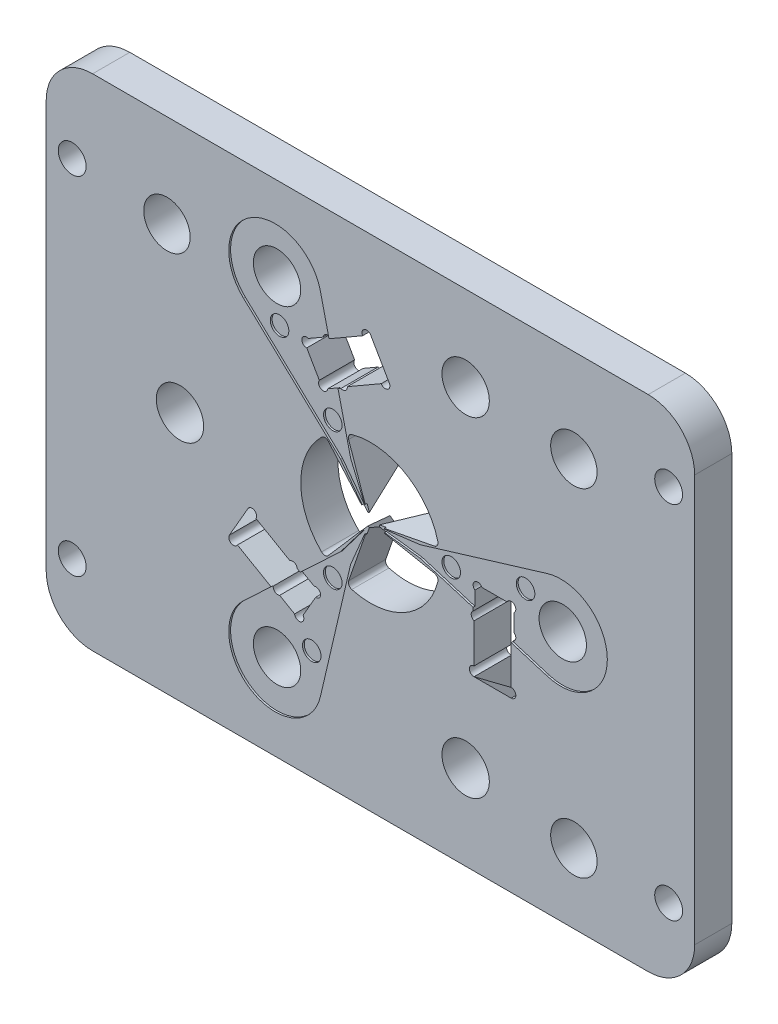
SolidWorks part; units mm, degrees
ref_plane "前基準面" through (0, 0, 0) normal (0, 0, 1) x (1, 0, 0)
ref_plane "上基準面" through (0, 0, 0) normal (0, 1, 0) x (1, 0, 0)
ref_plane "右基準面" through (0, 0, 0) normal (1, 0, 0) x (0, 0, -1)
sketch "草圖1" plane through (0, 0, 0) normal (0, 0, 1) x (1, 0, 0)
  line L1 (-38, 30) -> (38, 30)
  line L2 (-38, 30) -> (-38, -30)
  line L3 (-38, -30) -> (38, -30)
  line L4 (38, 30) -> (38, -30)
  line L5 (-38, 30) -> (38, -30) construction
  line L6 (-38, -30) -> (38, 30) construction
  point P0 (0, 0)
  point P28 (0, 0)
  dimension "D1" = 76
  dimension "D2" = 60
extrude "填料-伸長1" add sketch "草圖1" along normal blind 4
sketch "草圖2" plane through (0, 0, 4) normal (0, 0, 1) x (1, 0, 0)
  line L6 (0.3574, 0.005) -> (20.1903, 2.4807) construction
  line L7 (0.3574, -0.005) -> (20.1903, -2.4807) construction
  line L8 (0.3574, 0.005) -> (4.5094, 0.5233)
  line L9 (0.3574, -0.005) -> (4.5094, -0.5233)
  line L10 (6.1751, 0.8773) -> (19.0478, 4.7845)
  line L11 (6.1751, -0.8773) -> (19.0478, -4.7845)
  line L12 (-2.3278, -5.7864) -> (-5.3804, -18.8881)
  line L13 (-0.1744, -0.312) -> (-1.8015, -4.1669)
  line L14 (-0.183, -0.307) -> (-2.7079, -3.6436)
  line L15 (-3.8473, -4.9091) -> (-13.6674, -14.1037)
  line L16 (-3.8473, 4.9091) -> (-13.6674, 14.1037)
  line L17 (-0.183, 0.307) -> (-2.7079, 3.6436)
  line L18 (-0.1744, 0.312) -> (-1.8015, 4.1669)
  line L19 (-2.3278, 5.7864) -> (-5.3804, 18.8881)
  circle A7 centre (0, 0) radius 0.353 construction
  arc A8 (0.3574, 0.005) -> (0.3574, -0.005) centre (0.358, 0) ccw
  arc A9 (19.0478, -4.7845) -> (19.0478, 4.7845) centre (20.5, 0) ccw
  circle A10 centre (20.5, 0) radius 2.5 construction
  arc A11 (4.5094, -0.5233) -> (6.1751, -0.8773) centre (3.2707, -10.4463) cw
  arc A12 (4.5094, 0.5233) -> (6.1751, 0.8773) centre (3.2707, 10.4463) ccw
  arc A13 (-13.6674, -14.1037) -> (-5.3804, -18.8881) centre (-10.25, -17.7535) ccw
  arc A14 (-1.8015, -4.1669) -> (-2.3278, -5.7864) centre (7.4114, -8.0556) ccw
  arc A15 (-0.1744, -0.312) -> (-0.183, -0.307) centre (-0.179, -0.31) ccw
  arc A16 (-2.7079, -3.6436) -> (-3.8473, -4.9091) centre (-10.6821, 2.3906) cw
  arc A17 (-5.3804, 18.8881) -> (-13.6674, 14.1037) centre (-10.25, 17.7535) ccw
  arc A18 (-2.7079, 3.6436) -> (-3.8473, 4.9091) centre (-10.6821, -2.3906) ccw
  arc A19 (-0.183, 0.307) -> (-0.1744, 0.312) centre (-0.179, 0.31) ccw
  arc A20 (-1.8015, 4.1669) -> (-2.3278, 5.7864) centre (7.4114, 8.0556) cw
  point P17 (5.3574, -0.6291)
  point P20 (5.3574, 0.6291)
  point P46 (0, 0)
  dimension "D1" = 0.706
  dimension "D2" = 0.01
  dimension "D3" = 10
  dimension "D6" = 5
  dimension "D4" = 5
  dimension "D7" = 10
  dimension "D9" = 0.6201
  dimension "D5" = 20.5
  dimension "D8" = 3
extrude "除料-伸長1" cut sketch "草圖2" against normal blind 0.5
sketch "草圖3" plane through (0, 0, 3.5) normal (0, 0, 1) x (1, 0, 0)
  circle A0 centre (20.5, 0) radius 2.55
  circle A3 centre (-10.25, -17.7535) radius 2.55
  circle A4 centre (-10.25, 17.7535) radius 2.55
  point P9 (0, 0)
  dimension "D1" = 5.1
  dimension "D2" = 3
extrude "除料-伸長2" cut sketch "草圖3" against normal through all
sketch "草圖5" plane through (0, 0, 4) normal (0, 0, 1) x (1, 0, 0)
  circle A0 centre (-20.5, 0) radius 2.55
  circle A3 centre (10.25, 17.7535) radius 2.55
  circle A4 centre (10.25, -17.7535) radius 2.55
  point P9 (0, 0)
  dimension "D1" = 5.1
  dimension "D3" = 3
  dimension "D2" = 20.5
extrude "除料-伸長4" cut sketch "草圖5" against normal through all
sketch "草圖6" plane through (0, 0, 4) normal (0, 0, 1) x (1, 0, 0)
  line L0 (-29.9, 26.9) -> (29.9, 26.9)
  line L1 (-38, 30) -> (-38, -30) construction
  line L2 (38, -30) -> (38, 30) construction
  line L3 (-29.9, -26.9) -> (29.9, -26.9)
  line L4 (38, 30) -> (-38, 30) construction
  line L5 (-38, -30) -> (38, -30) construction
  line L6 (-34.9, 21.9) -> (-34.9, -21.9)
  line L7 (34.9, 21.9) -> (34.9, -21.9)
  arc A0 (34.9, 21.9) -> (29.9, 26.9) centre (29.9, 21.9) ccw
  arc A1 (29.9, -26.9) -> (34.9, -21.9) centre (29.9, -21.9) ccw
  arc A2 (-29.9, -26.9) -> (-34.9, -21.9) centre (-29.9, -21.9) cw
  arc A3 (-34.9, 21.9) -> (-29.9, 26.9) centre (-29.9, 21.9) cw
  dimension "D5" = 5
  dimension "D1" = 3.1
  dimension "D2" = 3.1
  dimension "D3" = 3.1
  dimension "D4" = 3.1
extrude "除料-伸長5" cut sketch "草圖6" against normal blind 10 contours L6 A3 L0 A0 L7 A1 L3 A2 M35 M32 M33 M34
ref_plane "平面1" through (0, 0, 4) normal (0, 0, 1) x (1, 0, 0)
sketch "草圖7" plane through (0, 0, 4) normal (0, 0, 1) x (1, 0, 0)
  line L0 (0, 0) -> (34.9, 0) construction
  line L1 (34.9, 21.9) -> (34.9, -21.9) construction
  line L2 (11.05, -0.2286) -> (15.25, -0.2286)
  line L3 (15.25, -0.2286) -> (15.25, -3.3286)
  line L4 (15.25, -3.3286) -> (11.05, -3.3286)
  line L5 (11.05, -3.3286) -> (11.05, -0.2286)
  line L6 (13.15, -0.2286) -> (13.15, -3.3286) construction
  line L7 (11.05, -1.7786) -> (15.25, -1.7786) construction
  line L8 (13.15, -1.7786) -> (11.05, -0.2286) construction
  line L13 (0, 0) -> (-12.75, 22.0836) construction
  line L14 (-6.575, 11.3882) -> (11.1068, 21.5968) construction
  line L15 (-7.4271, 13.3212) -> (-5.3271, 9.6839)
  line L20 (-7.4271, 13.3212) -> (-4.7424, 14.8712)
  line L21 (-4.7424, 14.8712) -> (-2.6424, 11.2339)
  line L22 (-2.6424, 11.2339) -> (-5.3271, 9.6839)
  line L23 (13.15, -1.7786) -> (13.15, -13.7786) construction
  line L24 (11.15, -7.7786) -> (15.15, -7.7786)
  line L25 (15.15, -7.7786) -> (15.15, -8.7786)
  line L26 (15.15, -8.7786) -> (11.15, -8.7786)
  line L27 (11.15, -8.7786) -> (11.15, -7.7786)
  line L28 (11.15, -8.2786) -> (15.15, -8.2786) construction
  line L29 (-6.0847, 14.0962) -> (-3.9847, 10.4589) construction
  line L34 (-7.4271, 13.3212) -> (-2.6424, 11.2339) construction
  line L35 (-4.7424, 14.8712) -> (-5.3271, 9.6839) construction
  line L40 (-0.8386, 17.0096) -> (1.1614, 13.5455)
  line L41 (-0.8386, 17.0096) -> (0.0275, 17.5096)
  line L42 (0.0275, 17.5096) -> (2.0275, 14.0455)
  line L43 (2.0275, 14.0455) -> (1.1614, 13.5455)
  line L44 (-0.4055, 17.2596) -> (1.5945, 13.7955) construction
  line L45 (0, 0) -> (-12.75, -22.0836) construction
  line L46 (-6.575, -11.3882) -> (-21.3666, -2.8483) construction
  line L47 (-5.7229, -9.4553) -> (-7.8229, -13.0926)
  line L48 (-5.7229, -9.4553) -> (-8.4076, -7.9053)
  line L49 (-8.4076, -7.9053) -> (-10.5076, -11.5426)
  line L50 (-10.5076, -11.5426) -> (-7.8229, -13.0926)
  line L51 (-7.0653, -8.6803) -> (-9.1653, -12.3176) construction
  line L52 (-8.4076, -7.9053) -> (-7.8229, -13.0926) construction
  line L53 (-10.5076, -11.5426) -> (-5.7229, -9.4553) construction
  line L54 (-12.3114, -5.7669) -> (-14.3114, -9.231)
  line L55 (-12.3114, -5.7669) -> (-13.1775, -5.2669)
  line L56 (-13.1775, -5.2669) -> (-15.1775, -8.731)
  line L57 (-15.1775, -8.731) -> (-14.3114, -9.231)
  line L58 (-12.7445, -5.5169) -> (-14.7445, -8.981) construction
  line L59 (-4.7841, 14.5007) -> (-3.8841, 12.9418) construction
  line L60 (-10.1659, -11.3935) -> (-9.2659, -9.8347) construction
  circle A0 centre (11.35, -0.45) radius 0.5
  circle A1 centre (14.95, -0.45) radius 0.5
  circle A2 centre (14.95, -3.1071) radius 0.5
  circle A3 centre (11.35, -3.1071) radius 0.5
  circle A4 centre (13.15, -0.9886) radius 0.15 construction
  arc A11 (-5.3804, 18.8881) -> (-13.6674, 14.1037) centre (-10.25, 17.7535) ccw construction
  circle A17 centre (-7.0853, 13.1721) radius 0.5
  circle A18 centre (11.15, -8.2786) radius 0.5
  circle A19 centre (15.15, -8.2786) radius 0.5
  circle A24 centre (-4.7841, 14.5007) radius 0.5
  circle A25 centre (-2.9841, 11.383) radius 0.5
  circle A26 centre (-5.2853, 10.0544) radius 0.5
  circle A27 centre (-0.4055, 17.2596) radius 0.5
  circle A28 centre (1.5945, 13.7955) radius 0.5
  arc A29 (-13.6674, -14.1037) -> (-5.3804, -18.8881) centre (-10.25, -17.7535) ccw construction
  circle A30 centre (-6.0647, -9.6044) radius 0.5
  circle A31 centre (-7.8647, -12.7221) radius 0.5
  circle A32 centre (-10.1659, -11.3935) radius 0.5
  circle A33 centre (-8.3659, -8.2758) radius 0.5
  circle A34 centre (-14.7445, -8.981) radius 0.5
  circle A35 centre (-12.7445, -5.5169) radius 0.5
  point P36 (-6.3771, 11.5025)
  point P43 (0.1614, 15.2775)
  point P66 (-6.7729, -11.2739)
  point P72 (13.15, -7.7786)
  point P81 (-13.3114, -7.4989)
  dimension "D3" = 1
  dimension "D4" = 0.3
  dimension "D10" = 13.15
  dimension "D16" = 1
  dimension "D19" = 4
  dimension "D26" = 1
  dimension "D1" = 4.2
  dimension "D2" = 3.1
  dimension "D5" = 0.79
  dimension "D8" = 0.45
  dimension "D9" = 13.15
  dimension "D11" = 4.2
  dimension "D12" = 3.1
  dimension "D13" = 4
  dimension "D14" = 1
  dimension "D15" = 4.95
  dimension "D17" = 0.3
  dimension "D18" = 0.45
  dimension "D20" = 1
  dimension "D21" = 4.95
  dimension "D22" = 0.3
  dimension "D23" = 13.15
  dimension "D24" = 4.2
  dimension "D25" = 3.1
  dimension "D27" = 0.3
  dimension "D28" = 0.45
  dimension "D29" = 4
  dimension "D30" = 1
  dimension "D31" = 4.95
extrude "除料-伸長6" cut sketch "草圖7" against normal through all
sketch "草圖8" plane through (0, 0, 0) normal (0, 0, 1) x (1, 0, 0)
  line L0 (-34.9, 21.9) -> (-24.9, 21.9) construction
  line L1 (-24.9, 21.9) -> (-24.9, -21.9) construction
  line L2 (-24.9, -21.9) -> (-34.9, -21.9) construction
  line L3 (-34.9, -21.9) -> (-34.9, 21.9) construction
  line L4 (-34.9, 0) -> (34.9, 0) construction
  line L5 (34.9, 21.9) -> (34.9, -21.9) construction
  line L6 (0, 26.9) -> (0, -26.9) construction
  line L7 (-29.9, 26.9) -> (29.9, 26.9) construction
  line L8 (-29.9, -26.9) -> (29.9, -26.9) construction
  circle A0 centre (-32.1, 17.9) radius 1.5
  circle A3 centre (32.1, 19.4) radius 1.5
  circle A4 centre (32.1, -19.4) radius 1.5
  circle A5 centre (-32.1, -19.4) radius 1.5
  dimension "D2" = 3
  dimension "D5" = 3
  dimension "D7" = 2.8
  dimension "D1" = 10
  dimension "D3" = 4
  dimension "D4" = 2.8
  dimension "D6" = 2.5
extrude "除料-伸長7" cut sketch "草圖8" along normal through all contours A3 | A5 | A4 | A0
sketch "草圖10" plane through (0, 0, 3.5) normal (0, 0, 1) x (1, 0, 0)
  line L48 (-3.8473, -4.9091) -> (-7.5662, -8.3911) construction
  line L49 (-7.5662, -8.3911) -> (-6.2611, -9.1446) construction
  line L50 (-6.0971, -10.1033) -> (-7.4488, -12.4446) construction
  line L51 (-8.3611, -12.7819) -> (-9.9695, -11.8533) construction
  line L52 (-10.6531, -11.2814) -> (-13.6674, -14.1037) construction
  line L53 (-5.3804, -18.8881) -> (-2.3278, -5.7864) construction
  line L54 (-1.8015, -4.1669) -> (-0.1744, -0.312) construction
  line L55 (-0.183, -0.307) -> (-2.7079, -3.6436) construction
  line L56 (11.05, -2.357) -> (11.05, -0.85) construction
  line L57 (11.7983, -0.2286) -> (14.5017, -0.2286) construction
  line L58 (15.25, -0.85) -> (15.25, -2.7071) construction
  line L59 (15.0966, -3.5852) -> (19.0478, -4.7845) construction
  line L60 (19.0478, 4.7845) -> (6.1751, 0.8773) construction
  line L61 (4.5094, 0.5233) -> (0.3574, 0.005) construction
  line L62 (0.3574, -0.005) -> (4.5094, -0.5233) construction
  line L63 (6.1751, -0.8773) -> (11.05, -2.357) construction
  line L64 (-3.4838, 10.7481) -> (-4.7889, 9.9946) construction
  line L65 (-5.7012, 10.3319) -> (-7.0529, 12.6731) construction
  line L66 (-6.8889, 13.6319) -> (-5.2805, 14.5605) construction
  line L67 (-4.4434, 14.8666) -> (-5.3804, 18.8881) construction
  line L68 (-13.6674, 14.1037) -> (-3.8473, 4.9091) construction
  line L69 (-2.7079, 3.6436) -> (-0.183, 0.307) construction
  line L70 (-0.1744, 0.312) -> (-1.8015, 4.1669) construction
  line L71 (-2.3278, 5.7864) -> (-3.4838, 10.7481) construction
  line L72 (-3.8473, -4.9091) -> (-7.5662, -8.3911)
  line L73 (-7.5662, -8.3911) -> (-6.2611, -9.1446)
  line L74 (-6.0971, -10.1033) -> (-7.4488, -12.4446)
  line L75 (-8.3611, -12.7819) -> (-9.9695, -11.8533)
  line L76 (-10.6531, -11.2814) -> (-13.6674, -14.1037)
  line L77 (-5.3804, -18.8881) -> (-2.3278, -5.7864)
  line L78 (-1.8015, -4.1669) -> (-0.1744, -0.312)
  line L79 (-0.183, -0.307) -> (-2.7079, -3.6436)
  line L80 (11.05, -2.357) -> (11.05, -0.85)
  line L81 (11.7983, -0.2286) -> (14.5017, -0.2286)
  line L82 (15.25, -0.85) -> (15.25, -2.7071)
  line L83 (15.0966, -3.5852) -> (19.0478, -4.7845)
  line L84 (19.0478, 4.7845) -> (6.1751, 0.8773)
  line L85 (4.5094, 0.5233) -> (0.3574, 0.005)
  line L86 (0.3574, -0.005) -> (4.5094, -0.5233)
  line L87 (6.1751, -0.8773) -> (11.05, -2.357)
  line L88 (-3.4838, 10.7481) -> (-4.7889, 9.9946)
  line L89 (-5.7012, 10.3319) -> (-7.0529, 12.6731)
  line L90 (-6.8889, 13.6319) -> (-5.2805, 14.5605)
  line L91 (-4.4434, 14.8666) -> (-5.3804, 18.8881)
  line L92 (-13.6674, 14.1037) -> (-3.8473, 4.9091)
  line L93 (-2.7079, 3.6436) -> (-0.183, 0.307)
  line L94 (-0.1744, 0.312) -> (-1.8015, 4.1669)
  line L95 (-2.3278, 5.7864) -> (-3.4838, 10.7481)
  circle A42 centre (-10.25, 17.7535) radius 2.55
  circle A43 centre (-10.25, -17.7535) radius 2.55
  circle A44 centre (20.5, 0) radius 2.55
  arc A45 (-6.0971, -10.1033) -> (-6.2611, -9.1446) centre (-6.0647, -9.6044) ccw construction
  arc A46 (-8.3611, -12.7819) -> (-7.4488, -12.4446) centre (-7.8647, -12.7221) ccw construction
  arc A47 (-10.6531, -11.2814) -> (-9.9695, -11.8533) centre (-10.1659, -11.3935) ccw construction
  arc A48 (-13.6674, -14.1037) -> (-5.3804, -18.8881) centre (-10.25, -17.7535) ccw construction
  arc A49 (-1.8015, -4.1669) -> (-2.3278, -5.7864) centre (7.4114, -8.0556) ccw construction
  arc A50 (-0.1744, -0.312) -> (-0.183, -0.307) centre (-0.179, -0.31) ccw construction
  arc A51 (-3.8473, -4.9091) -> (-2.7079, -3.6436) centre (-10.6821, 2.3906) ccw construction
  arc A52 (11.7983, -0.2286) -> (11.05, -0.85) centre (11.35, -0.45) ccw construction
  arc A53 (15.25, -0.85) -> (14.5017, -0.2286) centre (14.95, -0.45) ccw construction
  arc A54 (15.0966, -3.5852) -> (15.25, -2.7071) centre (14.95, -3.1071) ccw construction
  arc A55 (19.0478, -4.7845) -> (19.0478, 4.7845) centre (20.5, 0) ccw construction
  arc A56 (4.5094, 0.5233) -> (6.1751, 0.8773) centre (3.2707, 10.4463) ccw construction
  arc A57 (0.3574, 0.005) -> (0.3574, -0.005) centre (0.358, 0) ccw construction
  arc A58 (6.1751, -0.8773) -> (4.5094, -0.5233) centre (3.2707, -10.4463) ccw construction
  arc A59 (-5.7012, 10.3319) -> (-4.7889, 9.9946) centre (-5.2853, 10.0544) ccw construction
  arc A60 (-6.8889, 13.6319) -> (-7.0529, 12.6731) centre (-7.0853, 13.1721) ccw construction
  arc A61 (-4.4434, 14.8666) -> (-5.2805, 14.5605) centre (-4.7841, 14.5007) ccw construction
  arc A62 (-5.3804, 18.8881) -> (-13.6674, 14.1037) centre (-10.25, 17.7535) ccw construction
  arc A63 (-2.7079, 3.6436) -> (-3.8473, 4.9091) centre (-10.6821, -2.3906) ccw construction
  arc A64 (-0.183, 0.307) -> (-0.1744, 0.312) centre (-0.179, 0.31) ccw construction
  arc A65 (-2.3278, 5.7864) -> (-1.8015, 4.1669) centre (7.4114, 8.0556) ccw construction
  arc A66 (-6.0971, -10.1033) -> (-6.2611, -9.1446) centre (-6.0647, -9.6044) ccw
  arc A67 (-8.3611, -12.7819) -> (-7.4488, -12.4446) centre (-7.8647, -12.7221) ccw
  arc A68 (-10.6531, -11.2814) -> (-9.9695, -11.8533) centre (-10.1659, -11.3935) ccw
  arc A69 (-13.6674, -14.1037) -> (-5.3804, -18.8881) centre (-10.25, -17.7535) ccw
  arc A70 (-1.8015, -4.1669) -> (-2.3278, -5.7864) centre (7.4114, -8.0556) ccw
  arc A71 (-0.1744, -0.312) -> (-0.183, -0.307) centre (-0.179, -0.31) ccw
  arc A72 (-3.8473, -4.9091) -> (-2.7079, -3.6436) centre (-10.6821, 2.3906) ccw
  arc A73 (11.7983, -0.2286) -> (11.05, -0.85) centre (11.35, -0.45) ccw
  arc A74 (15.25, -0.85) -> (14.5017, -0.2286) centre (14.95, -0.45) ccw
  arc A75 (15.0966, -3.5852) -> (15.25, -2.7071) centre (14.95, -3.1071) ccw
  arc A76 (19.0478, -4.7845) -> (19.0478, 4.7845) centre (20.5, 0) ccw
  arc A77 (4.5094, 0.5233) -> (6.1751, 0.8773) centre (3.2707, 10.4463) ccw
  arc A78 (0.3574, 0.005) -> (0.3574, -0.005) centre (0.358, 0) ccw
  arc A79 (6.1751, -0.8773) -> (4.5094, -0.5233) centre (3.2707, -10.4463) ccw
  arc A80 (-5.7012, 10.3319) -> (-4.7889, 9.9946) centre (-5.2853, 10.0544) ccw
  arc A81 (-6.8889, 13.6319) -> (-7.0529, 12.6731) centre (-7.0853, 13.1721) ccw
  arc A82 (-4.4434, 14.8666) -> (-5.2805, 14.5605) centre (-4.7841, 14.5007) ccw
  arc A83 (-5.3804, 18.8881) -> (-13.6674, 14.1037) centre (-10.25, 17.7535) ccw
  arc A84 (-2.7079, 3.6436) -> (-3.8473, 4.9091) centre (-10.6821, -2.3906) ccw
  arc A85 (-0.183, 0.307) -> (-0.1744, 0.312) centre (-0.179, 0.31) ccw
  arc A86 (-2.3278, 5.7864) -> (-1.8015, 4.1669) centre (7.4114, 8.0556) ccw
  dimension "D1" = 5.1
  dimension "D2" = 5.1
  dimension "D3" = 5.1
extrude "填料-伸長2" add sketch "草圖10" along normal blind 0.5
sketch "草圖11" plane through (0, 0, 4) normal (0, 0, 1) x (1, 0, 0)
  line L0 (20.1778, 2.5296) -> (0.3574, 0.005) construction
  line L1 (0.3574, -0.005) -> (20.1778, -2.5296) construction
  line L2 (0.3574, 0.005) -> (5.3574, 0.6418) construction
  line L3 (0.3574, -0.005) -> (5.3574, -0.6418) construction
  line L4 (5.3574, 0.6418) -> (19.0519, 4.7857) construction
  line L5 (5.3574, -0.6418) -> (19.0519, -4.7857) construction
  line L6 (-0.183, -0.307) -> (-3.2345, -4.3187) construction
  line L7 (-3.2345, -4.3187) -> (-13.6705, -14.1066) construction
  line L8 (-2.1228, -4.9605) -> (-5.3814, -18.8923) construction
  line L9 (-0.1744, -0.312) -> (-2.1228, -4.9605) construction
  line L10 (-0.1744, 0.312) -> (-2.1228, 4.9605) construction
  line L11 (-2.1228, 4.9605) -> (-5.3814, 18.8923) construction
  line L12 (-3.2345, 4.3187) -> (-13.6705, 14.1066) construction
  line L13 (-0.183, 0.307) -> (-3.2345, 4.3187) construction
  line L14 (-0.1744, 0.312) -> (-2.1228, 4.9605) construction
  line L16 (-0.183, 0.307) -> (-3.2345, 4.3187) construction
  line L18 (-0.1744, -0.312) -> (-2.1228, -4.9605) construction
  line L20 (-0.183, -0.307) -> (-3.2345, -4.3187) construction
  line L22 (0.3574, -0.005) -> (5.3574, -0.6418) construction
  line L24 (0.3574, 0.005) -> (5.3574, 0.6418) construction
  line L26 (6.872, 1.2601) -> (0.3574, 0.005)
  line L27 (6.872, -1.2601) -> (0.3574, -0.005)
  line L32 (-2.3448, -6.5814) -> (-0.1744, -0.312)
  line L33 (-4.5273, -5.3213) -> (-0.183, -0.307)
  line L34 (-4.5273, 5.3213) -> (-0.183, 0.307)
  line L35 (-2.3448, 6.5814) -> (-0.1744, 0.312)
  circle A0 centre (0, 0) radius 0.353 construction
  arc A1 (0.3574, 0.005) -> (0.3574, -0.005) centre (0.358, 0) ccw construction
  circle A4 centre (20.5, 0) radius 2.55 construction
  circle A5 centre (20.5, 0) radius 2.55 construction
  arc A6 (19.0519, -4.7857) -> (19.0519, 4.7857) centre (20.5, 0) ccw construction
  arc A7 (-0.1744, -0.312) -> (-0.183, -0.307) centre (-0.179, -0.31) ccw construction
  arc A8 (-13.6705, -14.1066) -> (-5.3814, -18.8923) centre (-10.25, -17.7535) ccw construction
  arc A9 (-0.183, 0.307) -> (-0.1744, 0.312) centre (-0.179, 0.31) ccw construction
  arc A10 (-5.3814, 18.8923) -> (-13.6705, 14.1066) centre (-10.25, 17.7535) ccw construction
  arc A12 (-0.183, 0.307) -> (-0.1744, 0.312) centre (-0.179, 0.31) ccw
  arc A13 (-0.1744, -0.312) -> (-0.183, -0.307) centre (-0.179, -0.31) ccw
  arc A15 (0.3574, 0.005) -> (0.3574, -0.005) centre (0.358, 0) ccw
  arc A22 (-5.2555, 5.3506) -> (-5.2555, -5.3506) centre (0, 0) ccw
  arc A23 (-2.006, -7.2267) -> (7.2616, -1.8761) centre (0, 0) ccw
  arc A24 (7.2616, 1.8761) -> (-2.006, 7.2267) centre (0, 0) ccw
  arc A25 (6.872, 1.2601) -> (7.2616, 1.8761) centre (6.7775, 1.751) ccw
  arc A26 (6.872, -1.2601) -> (7.2616, -1.8761) centre (6.7775, -1.751) cw
  arc A27 (-2.3448, -6.5814) -> (-2.006, -7.2267) centre (-1.8723, -6.745) ccw
  arc A28 (-4.5273, -5.3213) -> (-5.2555, -5.3506) centre (-4.9052, -4.9939) cw
  arc A29 (-4.5273, 5.3213) -> (-5.2555, 5.3506) centre (-4.9052, 4.9939) ccw
  arc A30 (-2.3448, 6.5814) -> (-2.006, 7.2267) centre (-1.8723, 6.745) cw
  point P35 (0, 0)
  point P45 (7.3762, 1.3572)
  point P48 (0, 0)
  point P52 (7.3762, -1.3572)
  dimension "D1" = 0.706
  dimension "D2" = 0.01
  dimension "D3" = 5
  dimension "D4" = 10
  dimension "D6" = 15
  dimension "D7" = 0.1
  dimension "D10" = 0.5
  dimension "D11" = 0.5
  dimension "D12" = 0.5
  dimension "D13" = 0.5
  dimension "D14" = 0.5
  dimension "D15" = 0.5
  dimension "D8" = 0.1
  dimension "D9" = 3
  dimension "D5" = 3
extrude "除料-伸長9" cut sketch "草圖11" against normal through all
sketch "草圖12" plane through (0, 0, 0) normal (0, 1, 0) x (1, 0, 0)
  line L0 (0, 0) -> (0, -5.1664) construction
  line L2 (-29.9, 0) -> (29.9, 0) construction
  line L6 (0.353, -4.18) -> (0.353, 0)
  line L7 (0.353, 0) -> (2.7663, 0)
  line L8 (2.7663, 0) -> (0.353, -4.18)
  line L9 (-29.59, -4) -> (29.59, -4) construction
  dimension "D1" = 0.353
  dimension "D2" = 0.18
  dimension "D3" = 30
revolve "除料-旋轉1" cut sketch "草圖12" angle 360 about L0
sketch "草圖13" plane through (0, 0, 0) normal (0, 0, -1) x (-1, 0, 0)
  line L0 (29.9, 26.9) -> (-29.9, 26.9) construction
  line L1 (-34.9, 21.9) -> (-34.9, -21.9) construction
  line L2 (0, 26.9) -> (0, -26.9) construction
  line L3 (29.9, -26.9) -> (-29.9, -26.9) construction
  circle A0 centre (-21.9, 16.9) radius 2.5
  circle A1 centre (21.9, 16.9) radius 2.5
  circle A2 centre (-21.9, -19.4) radius 2.5
  dimension "D1" = 5
  dimension "D4" = 5
  dimension "D2" = 10
  dimension "D3" = 13
  dimension "D5" = 7.5
extrude "除料-伸長10" cut sketch "草圖13" against normal through all
sketch "草圖14" plane through (0, 0, 4) normal (0, 0, 1) x (1, 0, 0)
  line L0 (13.15, -0.2286) -> (13.15, -8.7786) construction
  line L1 (11.7983, -0.2286) -> (14.5017, -0.2286) construction
  line L2 (15.15, -8.7786) -> (11.15, -8.7786) construction
  line L3 (14.2511, -3.3286) -> (11.7983, -3.3286) construction
  line L4 (11.15, -3.3286) -> (15.15, -3.3286)
  line L5 (11.15, -3.3286) -> (11.15, -7.7786)
  line L6 (11.15, -7.7786) -> (15.15, -7.7786)
  line L7 (15.15, -3.3286) -> (15.15, -7.7786)
  line L8 (11.15, -3.3286) -> (15.15, -7.7786) construction
  line L9 (11.15, -7.7786) -> (15.15, -3.3286) construction
  line L10 (-6.3771, 11.5025) -> (1.0275, 15.7775) construction
  line L11 (-5.7012, 10.3319) -> (-7.0529, 12.6731) construction
  line L12 (0.0275, 17.5096) -> (2.0275, 14.0455) construction
  line L14 (-4.6924, 14.7846) -> (-2.6924, 11.3205)
  line L15 (-4.6924, 14.7846) -> (-0.8386, 17.0096)
  line L16 (-0.8386, 17.0096) -> (1.1614, 13.5455)
  line L17 (-2.6924, 11.3205) -> (1.1614, 13.5455)
  line L18 (-4.6924, 14.7846) -> (1.1614, 13.5455) construction
  line L19 (-0.8386, 17.0096) -> (-2.6924, 11.3205) construction
  line L21 (-0.8386, 17.0096) -> (1.1614, 13.5455) construction
  line L22 (-4.2429, 14.0061) -> (-3.0165, 11.8819) construction
  line L23 (-6.7729, -11.2739) -> (-13.3114, -7.4989) construction
  line L24 (-6.0971, -10.1033) -> (-7.4488, -12.4446) construction
  line L25 (-12.3114, -5.7669) -> (-14.3114, -9.231) construction
  line L26 (-8.7818, -8.5533) -> (-10.0082, -10.6776) construction
  line L27 (-14.3114, -9.231) -> (-12.3114, -5.7669)
  line L28 (-14.3114, -9.231) -> (-10.4576, -11.456)
  line L29 (-10.4576, -11.456) -> (-8.4576, -7.9919)
  line L30 (-12.3114, -5.7669) -> (-8.4576, -7.9919)
  line L31 (-14.3114, -9.231) -> (-8.4576, -7.9919) construction
  line L32 (-10.4576, -11.456) -> (-12.3114, -5.7669) construction
  point P6 (13.15, -5.5536)
  point P20 (-1.7655, 14.165)
  point P29 (-11.3845, -8.6114)
extrude "除料-伸長11" cut sketch "草圖14" against normal blind 0.9
sketch "草圖15" plane through (0, 0, 0) normal (0, 1, 0) x (1, 0, 0)
  line L0 (0, 0) -> (0, -4.2669) construction
  line L1 (0.353, 0) -> (0.353, -4.18)
  line L6 (-29.59, -4) -> (29.59, -4) construction
  line L7 (0.353, -4.18) -> (0.553, -4.18)
  line L8 (0.553, -4.18) -> (2.9663, 0)
  line L9 (0.353, 0) -> (2.9663, 0)
  line L10 (-29.9, 0) -> (29.9, 0) construction
  dimension "D1" = 0.353
  dimension "D2" = 0.18
  dimension "D3" = 30
  dimension "D4" = 0.2
revolve "除料-旋轉2" cut sketch "草圖15" angle 360 about L0
sketch "草圖16" plane through (0, 0, 4) normal (0, 0, 1) x (1, 0, 0)
  line L0 (0.3574, 0.005) -> (20.1903, 2.4807) construction
  line L1 (20.1903, -2.4807) -> (0.3574, -0.005) construction
  line L2 (0.3574, 0.005) -> (5.358, 0.6292)
  line L3 (0.3574, -0.005) -> (5.358, -0.6292)
  line L4 (5.358, 0.6292) -> (19.0478, 4.7845)
  line L5 (5.358, -0.6292) -> (19.0478, -4.7845)
  line L6 (-0.183, -0.307) -> (-3.2239, -4.3256)
  line L7 (-3.2239, -4.3256) -> (-13.6673, -14.1036)
  line L8 (-2.1341, -4.9548) -> (-5.3804, -18.8881)
  line L9 (-0.1744, -0.312) -> (-2.1341, -4.9548)
  line L10 (-0.1744, -0.312) -> (-7.9468, -18.7257) construction
  line L11 (-12.2436, -16.245) -> (-0.183, -0.307) construction
  line L12 (-0.1744, 0.312) -> (-2.1341, 4.9548)
  line L13 (-2.1341, 4.9548) -> (-5.3804, 18.8881)
  line L14 (-3.2239, 4.3256) -> (-13.6673, 14.1036)
  line L15 (-0.183, 0.307) -> (-3.2239, 4.3256)
  line L16 (-0.183, 0.307) -> (-12.2436, 16.245) construction
  line L17 (-7.9468, 18.7257) -> (-0.1744, 0.312) construction
  circle A0 centre (0, 0) radius 0.353 construction
  arc A1 (0.3574, 0.005) -> (0.3574, -0.005) centre (0.358, 0) ccw
  circle A2 centre (20.5, 0) radius 2.5 construction
  arc A4 (19.0478, -4.7845) -> (19.0478, 4.7845) centre (20.5, 0) ccw
  arc A5 (-0.1744, -0.312) -> (-0.183, -0.307) centre (-0.179, -0.31) ccw
  arc A6 (-13.6673, -14.1036) -> (-5.3804, -18.8881) centre (-10.25, -17.7535) ccw
  circle A7 centre (-10.25, -17.7535) radius 2.5 construction
  arc A8 (-0.183, 0.307) -> (-0.1744, 0.312) centre (-0.179, 0.31) ccw
  arc A9 (-5.3804, 18.8881) -> (-13.6673, 14.1036) centre (-10.25, 17.7535) ccw
  circle A10 centre (-10.25, 17.7535) radius 2.5 construction
  point P39 (0, 0)
  dimension "D1" = 0.706
  dimension "D2" = 0.01
  dimension "D3" = 5
  dimension "D4" = 10
  dimension "D5" = 5
  dimension "D6" = 3
extrude "除料-伸長12" cut sketch "草圖16" against normal blind 0.2
ref_plane "平面2" through (11.15, 0, 0) normal (1, 0, 0) x (0, 0, -1)
sketch "草圖17" plane through (11.15, 0, 0) normal (1, 0, 0) x (0, 0, -1)
  line L7 (0, -11.7786) -> (0, -8.7786)
  line L8 (0, -10.1033) -> (0, -12.4446) construction
  line L9 (0, -8.7786) -> (0, -7.7786) construction
  line L10 (0, -5.7669) -> (0, -9.231) construction
  line L11 (0, -8.7786) -> (-4, -8.7786)
  line L12 (-4, 29.59) -> (-4, -29.59) construction
  line L14 (-4, -8.7786) -> (0, -11.7786)
  line L22 (-4, -8.7786) -> (0, -8.7786)
  line L23 (0, -8.7786) -> (0, -7.7786)
  line L24 (0, -7.7786) -> (-3.1, -7.7786)
  line L25 (-3.1, -7.7786) -> (-4, -7.7786)
  line L26 (-4, -7.7786) -> (-4, -8.7786)
  line L27 (-4, -8.7786) -> (0, -8.7786) construction
  line L28 (0, -8.7786) -> (0, -7.7786) construction
  line L29 (0, -7.7786) -> (-3.1, -7.7786) construction
  line L30 (-3.1, -7.7786) -> (-4, -7.7786) construction
  line L31 (-4, -7.7786) -> (-4, -8.7786) construction
  dimension "D1" = 3
  dimension "D2" = 0
extrude "除料-伸長15" cut sketch "草圖17" along normal blind 4
ref_plane "平面3" through (-5.575, 9.6562, 0) normal (-0.5, 0.866, 0) x (0.866, 0.5, 0)
sketch "草圖18" plane through (-5.575, 9.6562, 0) normal (-0.5, 0.866, 0) x (0.866, 0.5, 0)
  line L7 (8.7786, -4) -> (8.7786, 0)
  line L8 (8.7786, 0) -> (11.7786, 0)
  line L9 (10.1033, 0) -> (12.4446, 0) construction
  line L10 (11.7786, 0) -> (8.7786, -4)
  line L12 (7.7786, 0) -> (7.7786, -3.1)
  line L13 (7.7786, -3.1) -> (7.7786, -4)
  line L14 (7.7786, -4) -> (8.7786, -4)
  line L15 (8.7786, -4) -> (8.7786, 0)
  line L16 (8.7786, 0) -> (7.7786, 0)
  line L17 (7.7786, 0) -> (7.7786, -3.1) construction
  line L18 (7.7786, -3.1) -> (7.7786, -4) construction
  line L19 (7.7786, -4) -> (8.7786, -4) construction
  line L20 (8.7786, -4) -> (8.7786, 0) construction
  line L21 (8.7786, 0) -> (7.7786, 0) construction
  dimension "D1" = 3
  dimension "D2" = 0
extrude "除料-伸長16" cut sketch "草圖18" along normal blind 4
ref_plane "平面4" through (-5.575, -9.6562, 0) normal (-0.5, -0.866, 0) x (-0.866, 0.5, 0)
sketch "草圖19" plane through (-5.575, -9.6562, 0) normal (-0.5, -0.866, 0) x (-0.866, 0.5, 0)
  line L4 (8.7786, -4) -> (8.7786, 0)
  line L5 (7.7786, 0) -> (7.7786, -3.1)
  line L6 (7.7786, -3.1) -> (7.7786, -4)
  line L7 (7.7786, -4) -> (8.7786, -4)
  line L8 (8.7786, -4) -> (8.7786, 0)
  line L9 (8.7786, 0) -> (7.7786, 0)
  line L10 (7.7786, 0) -> (7.7786, -3.1) construction
  line L11 (7.7786, -3.1) -> (7.7786, -4) construction
  line L12 (7.7786, -4) -> (8.7786, -4) construction
  line L13 (8.7786, -4) -> (8.7786, 0) construction
  line L14 (8.7786, 0) -> (7.7786, 0) construction
  line L15 (8.7786, 0) -> (11.7786, 0)
  line L16 (12.4446, 0) -> (10.1033, 0) construction
  line L17 (11.7786, 0) -> (8.7786, -4)
  dimension "D2" = 3
  dimension "D1" = 0
extrude "除料-伸長17" cut sketch "草圖19" along normal blind 4
ref_plane "平面5" through (0, 0, 4) normal (0, 0, 1) x (1, 0, 0)
sketch "草圖20" plane through (0, 0, 4) normal (0, 0, 1) x (1, 0, 0)
  line L0 (0, 0) -> (34.9, 0) construction
  line L1 (34.9, 21.9) -> (34.9, -21.9) construction
  line L2 (1.5193, 0) -> (1.5193, 0.15) construction
  line L3 (5.358, 0.6292) -> (0.6556, 0.0422) construction
  circle A0 centre (0, 0) radius 1.5266
  dimension "D1" = 0.15
extrude "除料-伸長18" cut sketch "草圖20" against normal blind 0.2
ref_plane "平面6" through (0, 0, 3.8) normal (0, 0, 1) x (1, 0, 0)
sketch "草圖21" plane through (0, 0, 3.8) normal (0, 0, 1) x (1, 0, 0)
  line L0 (0, 0) -> (34.9, 0) construction
  line L1 (34.9, 21.9) -> (34.9, -21.9) construction
  line L2 (16.5, 0) -> (16.5, 2) construction
  circle A0 centre (8.5, 0) radius 1
  circle A1 centre (16.5, 2) radius 1
  circle A2 centre (-6.5179, -15.2894) radius 1
  circle A3 centre (-4.25, -7.3612) radius 1
  circle A4 centre (-9.9821, 13.2894) radius 1
  circle A5 centre (-4.25, 7.3612) radius 1
  point P20 (0, 0)
  dimension "D1" = 2
  dimension "D5" = 2
  dimension "D2" = 8.5
  dimension "D3" = 8
  dimension "D4" = 2
  dimension "D6" = 3
extrude "除料-伸長19" cut sketch "草圖21" against normal blind 0.2
sketch "草圖22" plane through (0, 0, 3.1) normal (0, 0, 1) x (1, 0, 0)
  line L4 (-4.3682, 14.2231) -> (-3.0165, 11.8819)
  line L5 (-2.4873, 11.4389) -> (1.1614, 13.5455)
  line L6 (1.1614, 13.5455) -> (-0.8386, 17.0096)
  line L7 (-0.8386, 17.0096) -> (-4.4873, 14.903)
  line L8 (-4.3682, 14.2231) -> (-3.0165, 11.8819)
  line L9 (-2.4873, 11.4389) -> (1.1614, 13.5455)
  line L10 (1.1614, 13.5455) -> (-0.8386, 17.0096)
  line L11 (-0.8386, 17.0096) -> (-4.4873, 14.903)
  line L12 (-10.1335, -10.8946) -> (-8.7818, -8.5533)
  line L13 (-8.6627, -7.8735) -> (-12.3114, -5.7669)
  line L14 (-12.3114, -5.7669) -> (-14.3114, -9.231)
  line L15 (-14.3114, -9.231) -> (-10.6627, -11.3376)
  line L16 (-10.1335, -10.8946) -> (-8.7818, -8.5533)
  line L17 (-8.6627, -7.8735) -> (-12.3114, -5.7669)
  line L18 (-12.3114, -5.7669) -> (-14.3114, -9.231)
  line L19 (-14.3114, -9.231) -> (-10.6627, -11.3376)
  line L20 (14.5017, -3.3286) -> (11.7983, -3.3286)
  line L21 (11.15, -3.5654) -> (11.15, -7.7786)
  line L22 (11.15, -7.7786) -> (15.15, -7.7786)
  line L23 (15.15, -7.7786) -> (15.15, -3.5654)
  line L24 (14.5017, -3.3286) -> (11.7983, -3.3286)
  line L25 (11.15, -3.5654) -> (11.15, -7.7786)
  line L26 (11.15, -7.7786) -> (15.15, -7.7786)
  line L27 (15.15, -7.7786) -> (15.15, -3.5654)
  arc A2 (-4.3682, 14.2231) -> (-4.4873, 14.903) centre (-4.7841, 14.5007) ccw
  arc A3 (-2.4873, 11.4389) -> (-3.0165, 11.8819) centre (-2.9841, 11.383) ccw
  arc A4 (-4.3682, 14.2231) -> (-4.4873, 14.903) centre (-4.7841, 14.5007) ccw
  arc A5 (-2.4873, 11.4389) -> (-3.0165, 11.8819) centre (-2.9841, 11.383) ccw
  arc A6 (-10.1335, -10.8946) -> (-10.6627, -11.3376) centre (-10.1659, -11.3935) ccw
  arc A7 (-8.6627, -7.8735) -> (-8.7818, -8.5533) centre (-8.3659, -8.2758) ccw
  arc A8 (-10.1335, -10.8946) -> (-10.6627, -11.3376) centre (-10.1659, -11.3935) ccw
  arc A9 (-8.6627, -7.8735) -> (-8.7818, -8.5533) centre (-8.3659, -8.2758) ccw
  arc A10 (14.5017, -3.3286) -> (15.15, -3.5654) centre (14.95, -3.1071) ccw
  arc A11 (11.15, -3.5654) -> (11.7983, -3.3286) centre (11.35, -3.1071) ccw
  arc A12 (14.5017, -3.3286) -> (15.15, -3.5654) centre (14.95, -3.1071) ccw
  arc A13 (11.15, -3.5654) -> (11.7983, -3.3286) centre (11.35, -3.1071) ccw
  dimension "D1" = 0
  dimension "D2" = 0
  dimension "D3" = 0
extrude "除料-伸長20" cut sketch "草圖22" against normal through all
extrude "除料-伸長21" cut sketch "草圖23" against normal blind 4
sketch "草圖23" [suppressed] plane through (0, 0, 0) normal (0, 0, -1) x (-1, 0, 0)
  line L7 (0, 0) -> (13.8, -23.9023)
  line L8 (-20.5, 6.3207) -> (-20.5, -5.6276)
  line L9 (0, 0) -> (-20.5, 0)
  line L10 (0, 0) -> (13.8944, 24.0659)
  circle A9 centre (-20.5, -6.1) radius 1
  circle A10 centre (-26.6, 0) radius 1
  circle A11 centre (-20.5, 6.1) radius 1
  circle A17 centre (10.67, 23.8535) radius 1
  circle A20 centre (10.67, 23.8535) radius 1
  circle A30 centre (-26.6, 0) radius 1
  circle A32 centre (-20.5, -6.1) radius 1
  circle A34 centre (-20.5, 6.1) radius 1
  circle A38 centre (10.67, -23.8535) radius 1
  circle A39 centre (16.2412, 18.9005) radius 1
  circle A40 centre (10.6517, 9.7731) radius 1
  circle A41 centre (16.2412, -18.9005) radius 1
  circle A42 centre (13.5886, -12.523) radius 1
